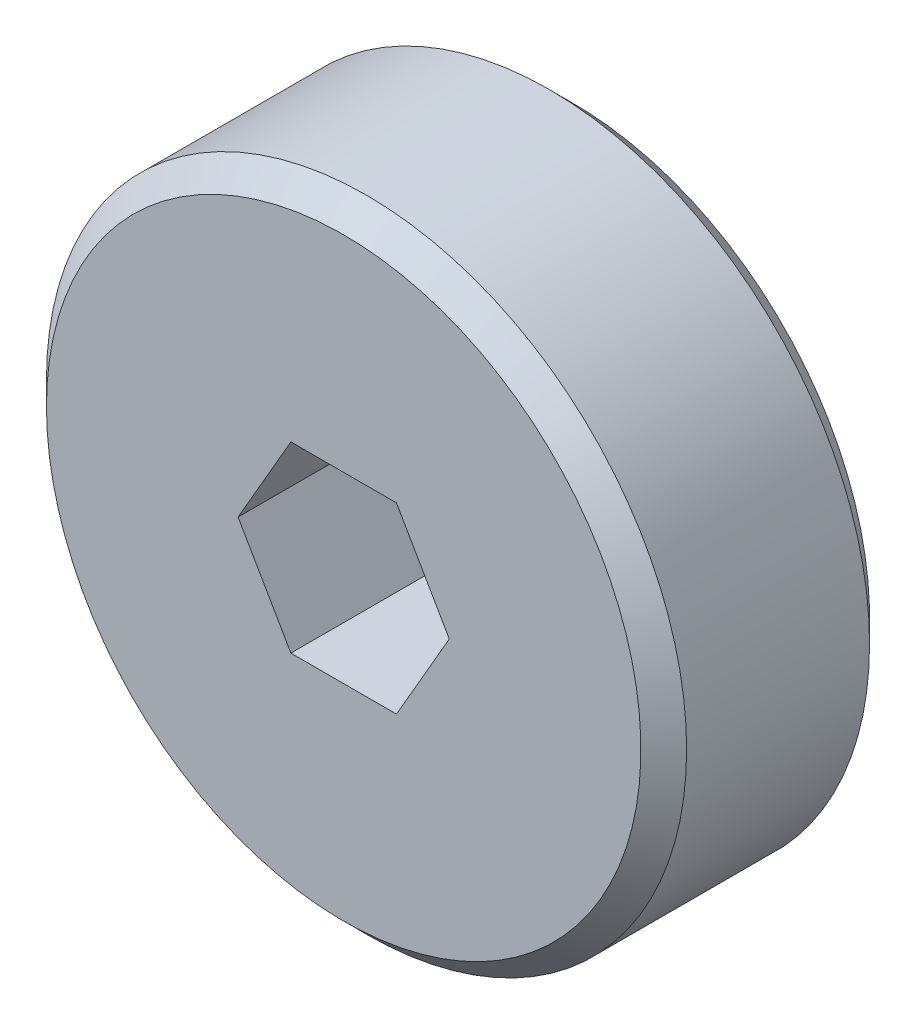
SolidWorks part; units mm, degrees
ref_plane "Front" through (0, 0, 0) normal (0, 0, 1) x (1, 0, 0)
ref_plane "Top" through (0, 0, 0) normal (0, 1, 0) x (1, 0, 0)
ref_plane "Right" through (0, 0, 0) normal (1, 0, 0) x (0, 0, -1)
sketch "Logo3_Revol_Axis" plane through (0, 0, 0) normal (0, 1, 0) x (1, 0, 0)
  line L0 (0, -43.5172) -> (0, 43.5172) construction
sketch "Logo3_bib1" plane through (0, 0, 0) normal (0, -1, 0) x (-1, 0, 0)
  line L0 (0, -7.9375) -> (0, 0)
  line L1 (0, 0) -> (10.3188, 0)
  line L5 (11.1125, -7.1437) -> (10.3188, -7.9375)
  line L6 (10.3188, -7.9375) -> (0, -7.9375)
  line L8 (10.3188, 0) -> (11.1125, -0.7937)
  line L9 (11.1125, -0.7937) -> (11.1125, -7.1437)
  line L10 (0, 10.5852) -> (0, -63.2873) construction
revolve "Revolve1" add sketch "Logo3_bib1" angle 360 about L10
sketch "Logo3_bib2" plane through (0, 0, 0) normal (0, 0, -1) x (1, 0, 0)
  line L1 (3.6662, 0) -> (1.8331, 3.175)
  line L2 (1.8331, 3.175) -> (-1.8331, 3.175)
  line L3 (-1.8331, 3.175) -> (-3.6662, 0)
  line L4 (-3.6662, 0) -> (-1.8331, -3.175)
  line L5 (-1.8331, -3.175) -> (1.8331, -3.175)
  line L6 (1.8331, -3.175) -> (3.6662, 0)
  circle A0 centre (0, 0) radius 3.175 construction
  dimension "Logo3_c1" = 6.35
extrude "Cut-Extrude1" cut sketch "Logo3_bib2" against normal through all
equation "\"D2@Cosmetic Thread1\" = \"Logo3_d1-pas@Logo3_bib1\""
